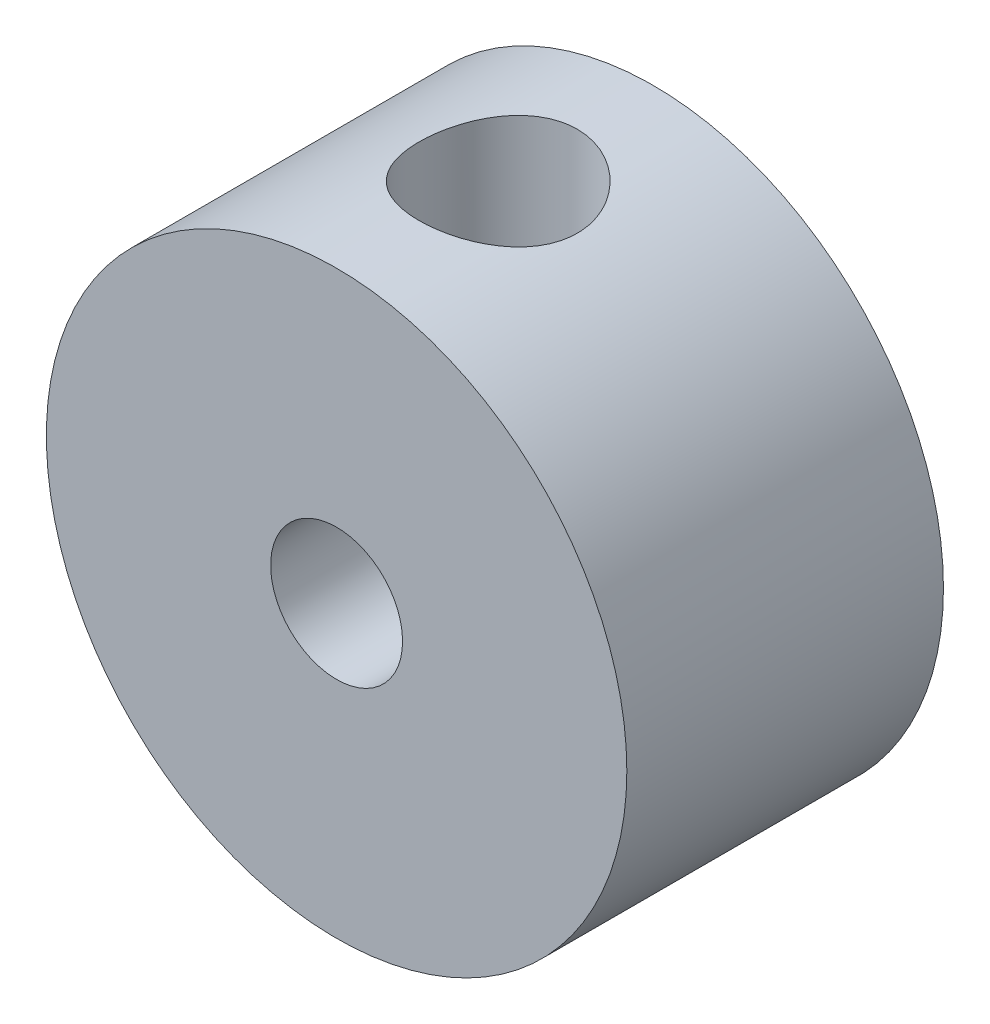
SolidWorks part; units mm, degrees
ref_plane "Alzado" through (0, 0, 0) normal (0, 0, 1) x (1, 0, 0)
ref_plane "Planta" through (0, 0, 0) normal (0, 1, 0) x (1, 0, 0)
ref_plane "Vista lateral" through (0, 0, 0) normal (1, 0, 0) x (0, 0, -1)
sketch "Croquis1" plane through (0, 0, 0) normal (0, 0, 1) x (1, 0, 0)
  circle A0 centre (0, 0) radius 1.25
  circle A1 centre (0, 0) radius 5.5
  dimension "D1" = 2.5
  dimension "D2" = 11
extrude "Saliente-Extruir1" add sketch "Croquis1" along normal blind 6
sketch "Croquis2" plane through (0, 0, 0) normal (0, 1, 0) x (1, 0, 0)
  circle A0 centre (0, -2.9383) radius 1.5
  point P2 (0, 0)
  point P3 (0, -2.5061)
  point P5 (0, -2.9383)
  dimension "D1" = 3
extrude "Cortar-Extruir1" cut sketch "Croquis2" along normal up to next
